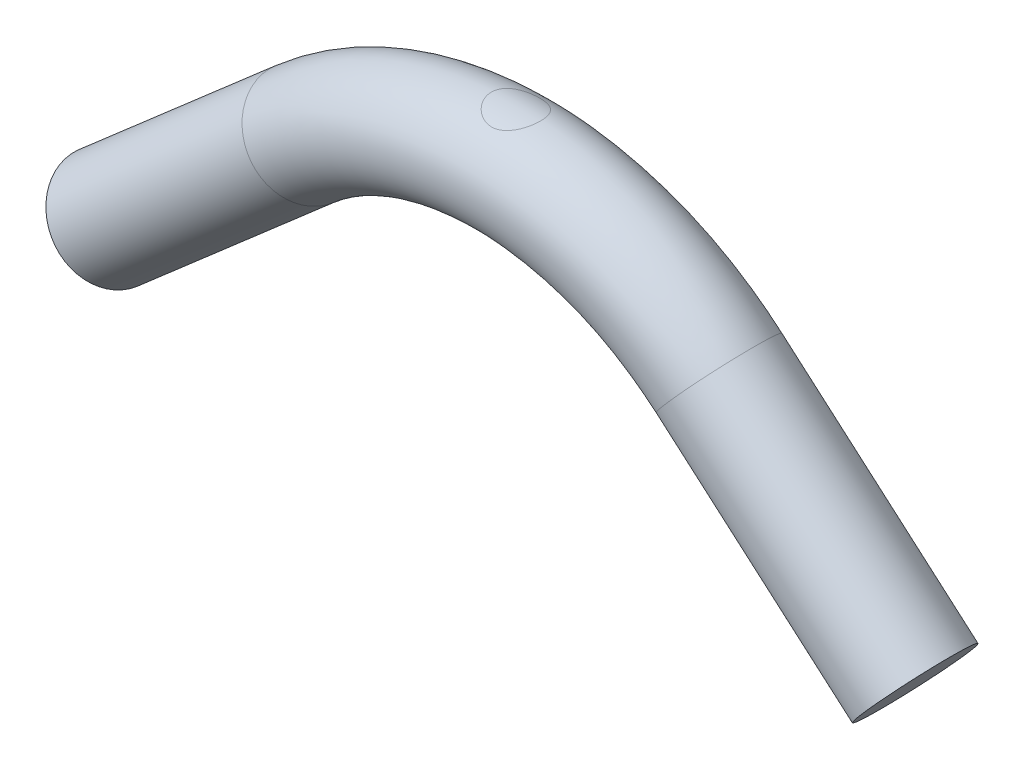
SolidWorks part; units mm, degrees
ref_plane "Front Plane" through (0, 0, 0) normal (0, 0, 1) x (1, 0, 0)
ref_plane "Top Plane" through (0, 0, 0) normal (0, 1, 0) x (1, 0, 0)
ref_plane "Right Plane" through (0, 0, 0) normal (1, 0, 0) x (0, 0, -1)
sketch "Sketch1" plane through (0, 0, 0) normal (0, 0, 1) x (1, 0, 0)
  line L0 (0, 0) -> (230, 0) construction
  line L1 (115, 0) -> (115, 70) construction
  line L2 (115, 70) -> (115, 100) construction
  line L3 (0, 0) -> (55.9439, 48.6469)
  line L4 (230, 0) -> (174.0561, 48.6469)
  arc A0 (174.0561, 48.6469) -> (55.9439, 48.6469) centre (115, -19.2676) ccw
  point P9 (115, 70.7324)
  dimension "D2" = 70
  dimension "D4" = 90
  dimension "D1" = 230
  dimension "D3" = 30
ref_plane "Plane1" through (115, 0, 0) normal (1, 0, 0) x (0, 0, -1)
sketch "Sketch3" plane through (115, 0, 0) normal (1, 0, 0) x (0, 0, -1)
  circle A0 centre (0, 70.7324) radius 15
sweep "Sweep1" add profiles "Sketch3" path "Sketch1"
mirror "Mirror1" about plane through (115, 0, 0) normal (1, 0, 0) of "Sweep1"
sketch "Sketch4" plane through (0, 0, 0) normal (0, 1, 0) x (1, 0, 0)
  circle A0 centre (116.1146, 0) radius 7
